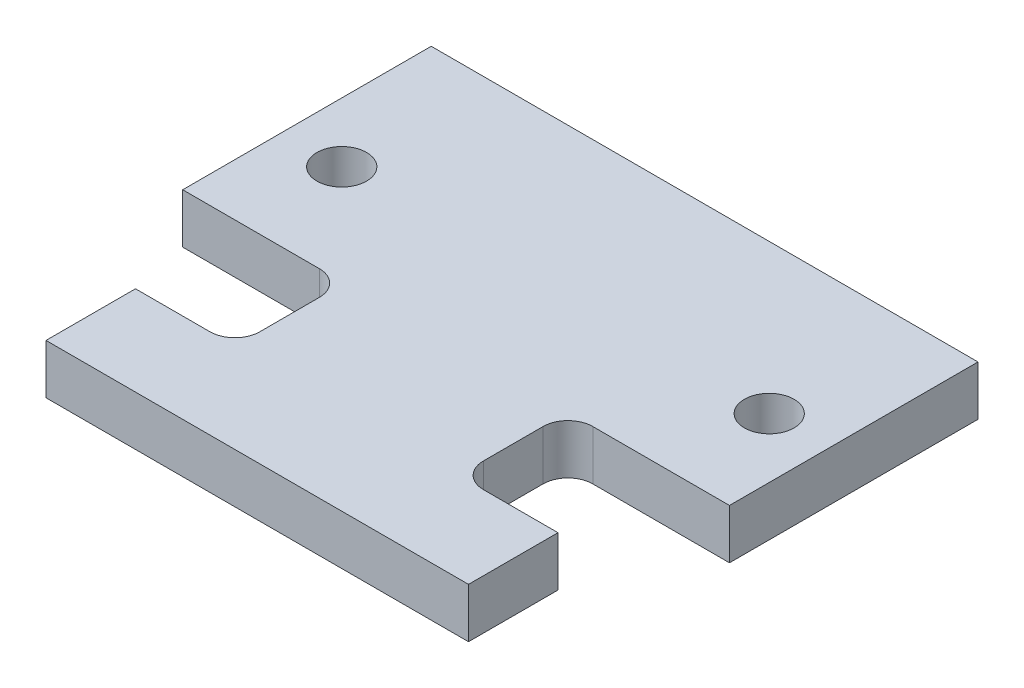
SolidWorks part; units mm, degrees
ref_plane "Front" through (0, 0, 0) normal (0, 0, 1) x (1, 0, 0)
ref_plane "Top" through (0, 0, 0) normal (0, 1, 0) x (1, 0, 0)
ref_plane "Right" through (0, 0, 0) normal (1, 0, 0) x (0, 0, -1)
sketch "Sketch1" plane through (0, 0, 0) normal (0, 1, 0) x (1, 0, 0)
  line L0 (22.5, -50) -> (55, -50)
  line L1 (-55, 0) -> (55, 0)
  line L2 (-55, 0) -> (-55, -50)
  line L3 (-55, -50) -> (-22.5, -50)
  line L4 (55, 0) -> (55, -50)
  line L5 (0, 0) -> (0, -90) construction
  line L6 (-22.5, -50) -> (-22.5, -72)
  line L7 (22.5, -72) -> (42.5, -72)
  line L8 (22.5, -50) -> (22.5, -72)
  line L9 (-42.5, -72) -> (-22.5, -72)
  line L10 (-42.5, -72) -> (-42.5, -90)
  line L11 (-42.5, -90) -> (42.5, -90)
  line L12 (42.5, -72) -> (42.5, -90)
extrude "Boss-Extrude1" add sketch "Sketch1" along normal blind 10
sketch "Sketch2" plane through (0, 10, 0) normal (0, 1, 0) x (1, 0, 0)
  line L0 (43, 0) -> (43, -30) construction
  line L1 (55, 0) -> (-55, 0) construction
  line L2 (43, -30) -> (55, -30) construction
  line L3 (55, -50) -> (55, 0) construction
  circle A0 centre (43, -30) radius 5
extrude "Cut-Extrude1" cut sketch "Sketch2" against normal through all
mirror "Mirror1" about plane through (0, 0, 0) normal (1, 0, 0) of "Cut-Extrude1"
fillet "Fillet1" radius 5 4 edges at (22.5, 5, 50) (22.5, 5, 72) (-22.5, 5, 72) (-22.5, 5, 50)
equation "\"Var1\"= 0.6"
equation "\"D3@Sketch2\"= \"D4@Sketch1\" * \"Var1\""
